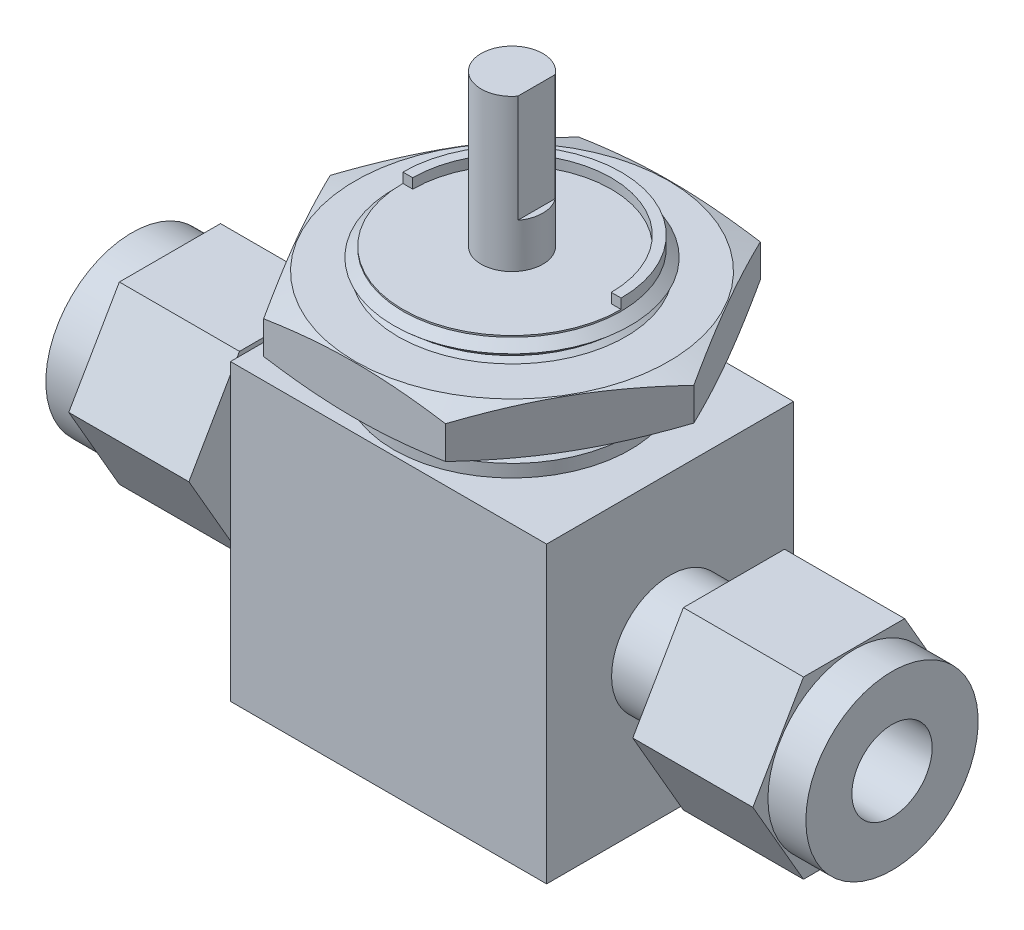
SolidWorks part; units mm, degrees
ref_plane "Front" through (0, 0, 0) normal (0, 0, 1) x (1, 0, 0)
ref_plane "Top" through (0, 0, 0) normal (0, 1, 0) x (1, 0, 0)
ref_plane "Right" through (0, 0, 0) normal (1, 0, 0) x (0, 0, -1)
sketch "Sketch1" plane through (0, 0, 0) normal (0, 0, 1) x (1, 0, 0)
  line L0 (-12.7, 11.8237) -> (12.7, 11.8237)
  line L1 (-12.7, 11.8237) -> (-12.7, -11.8237)
  line L2 (12.7, -11.8237) -> (-12.7, -11.8237)
  line L3 (12.7, -11.8237) -> (12.7, 11.8237)
  dimension "D1" = 25.4
  dimension "D2" = 23.6474
  dimension "D3" = 12.7
  dimension "D4" = 11.8237
extrude "Body" add sketch "Sketch1" along normal blind 9.9187 and the other way blind 9.9187
sketch "Sketch2" plane through (12.7, 0, 0) normal (1, 0, 0) x (0, 0, -1)
  circle A0 centre (0, 0) radius 4.699
  dimension "D1" = 9.398
extrude "Boss" add sketch "Sketch2" along normal blind 5.1308
sketch "Sketch3" plane through (17.8308, 0, 0) normal (1, 0, 0) x (0, 0, -1)
  line L0 (0, 0) -> (13.9578, 0) construction
  line L1 (0, 0) -> (-11.692, 0) construction
  line L2 (-4.064, 7.0391) -> (4.064, 7.0391)
  line L3 (4.064, 7.0391) -> (8.128, 0)
  line L4 (8.128, 0) -> (4.064, -7.0391)
  line L5 (4.064, -7.0391) -> (-4.064, -7.0391)
  line L6 (-4.064, -7.0391) -> (-8.128, 0)
  line L7 (-8.128, 0) -> (-4.064, 7.0391)
  line L8 (0, 0) -> (4.064, 7.0391) construction
  circle A0 centre (0, 0) radius 8.128 construction
  dimension "D1" = 16.256
  dimension "D2" = 60
  dimension "D3" = 8.128
  dimension "D4" = 8.128
  dimension "D5" = 120
  dimension "D6" = 120
  dimension "D7" = 8.128
extrude "Hex" add sketch "Sketch3" along normal blind 9.652
sketch "Sketch4" plane through (27.4828, 0, 0) normal (1, 0, 0) x (0, 0, -1)
  circle A0 centre (0, 0) radius 6.9215
  dimension "D1" = 13.843
extrude "Boss-Extrude3" add sketch "Sketch4" along normal blind 3.048
sketch "Sketch5" plane through (30.5308, 0, 0) normal (1, 0, 0) x (0, 0, -1)
  circle A0 centre (0, 0) radius 3.2258
  dimension "D1" = 6.4516
extrude "TubeBore" cut sketch "Sketch5" against normal blind 15.2908
mirror "Mirror1" about plane through (0, 0, 0) normal (1, 0, 0) of "TubeBore", "Boss", "Hex", "Boss-Extrude3"
sketch "Sketch6" plane through (0, 11.8237, 0) normal (0, 1, 0) x (-1, 0, 0)
  circle A0 centre (0, 0) radius 9.4996
  dimension "D1" = 18.9992
extrude "PackingBoss" add sketch "Sketch6" along normal blind 9.398
sketch "Sketch14" plane through (0, 0, 0) normal (0, 0, 1) x (1, 0, 0)
  line L0 (0, 0) -> (0, 30.8771) construction
  line L1 (9.4996, 12.8397) -> (8.7694, 13.4747)
  line L2 (9.4996, 11.8237) -> (9.4996, 21.2217) construction
  line L3 (8.7694, 13.4747) -> (9.4996, 14.1097)
  line L4 (9.4996, 14.1097) -> (8.7694, 14.7447)
  line L5 (8.7694, 14.7447) -> (9.4996, 15.3797)
  line L6 (9.4996, 15.3797) -> (8.7694, 16.0147)
  line L7 (8.7694, 16.0147) -> (9.4996, 16.6497)
  line L8 (9.4996, 16.6497) -> (8.7694, 17.2847)
  line L9 (8.7694, 17.2847) -> (9.4996, 17.9197)
  line L10 (9.4996, 17.9197) -> (8.7693, 18.5547)
  line L11 (8.7693, 18.5547) -> (9.4996, 19.1897)
  line L12 (9.4996, 19.1897) -> (8.7693, 19.8247)
  line L13 (8.7693, 19.8247) -> (9.4996, 20.4597)
  line L14 (-12.7, 11.8237) -> (12.7, 11.8237) construction
  line L15 (9.4996, 20.4597) -> (8.7694, 21.0947)
  line L18 (8.7694, 21.0947) -> (8.7694, 22.3647)
  line L19 (10.0703, 22.3647) -> (10.0703, 12.8397)
  line L20 (10.0703, 12.8397) -> (9.4996, 12.8397)
  line L23 (8.7694, 22.3647) -> (10.0703, 22.3647)
  dimension "D1" = 17.5387
  dimension "D2" = 1.016
  dimension "D3" = 1.27
revolve "3/4-20 unef" cut sketch "Sketch14" angle 360 about L0
sketch "Sketch7" plane through (0, 21.2217, 0) normal (0, 1, 0) x (-1, 0, 0)
  line L0 (-7.9756, 0) -> (-8.7694, 0)
  line L4 (7.9756, 0) -> (8.7694, 0)
  arc A0 (8.7694, 0) -> (-8.7694, 0) centre (0, 0) cw
  arc A1 (7.9756, 0) -> (-7.9756, 0) centre (0, 0) cw
  circle A2 centre (0, 0) radius 8.7694 construction
  dimension "D1" = 0.7937
extrude "Boss-Extrude4" add sketch "Sketch7" along normal blind 0.7937
sketch "Sketch16" plane through (0, 21.2217, 0) normal (0, 1, 0) x (1, 0, 0)
  circle A0 centre (0, 0) radius 2.4765
  dimension "D1" = 4.953
extrude "Boss-Extrude5" add sketch "Sketch16" along normal blind 12.192
sketch "Sketch17" plane through (0, 33.4137, 0) normal (0, 1, 0) x (1, 0, 0)
  line L1 (1.9685, 6.8634) -> (5.2713, 6.8634)
  line L2 (1.9685, 6.8634) -> (1.9685, -4.4524)
  line L3 (1.9685, -4.4524) -> (5.2713, -4.4524)
  line L4 (5.2713, 6.8634) -> (5.2713, -4.4524)
  circle A0 centre (0, 0) radius 2.4765 construction
  dimension "D1" = 4.445
extrude "Cut-Extrude1" cut sketch "Sketch17" against normal blind 8.636
sketch "Sketch12" plane through (30.5308, 0, 0) normal (1, 0, 0) x (0, 0, -1)
  circle A0 centre (0, 0) radius 2.3749
  dimension "D1" = 4.7498
extrude "Hole" cut sketch "Sketch12" against normal through all
ref_plane "Plane1" through (0, 21.0918, 0) normal (0, 1, 0) x (-1, 0, 0)
sketch "Sketch18" plane through (0, 21.0918, 0) normal (0, 1, 0) x (-1, 0, 0)
  line L1 (-14.606, 0) -> (-7.303, -12.6492)
  line L2 (-7.303, -12.6492) -> (7.303, -12.6492)
  line L3 (7.303, -12.6492) -> (14.606, 0)
  line L4 (14.606, 0) -> (7.303, 12.6492)
  line L5 (7.303, 12.6492) -> (-7.303, 12.6492)
  line L6 (-7.303, 12.6492) -> (-14.606, 0)
  circle A0 centre (0, 0) radius 12.6492 construction
  circle A1 centre (0, 0) radius 9.0678
  dimension "D1" = 25.2984
  dimension "D2" = 18.1356
extrude "Hex Nut" add sketch "Sketch18" against normal blind 3.9116 from offset 1.5875
sketch "Sketch19" plane through (0, 0, 0) normal (0, 0, 1) x (1, 0, 0)
  line L0 (0, 0) -> (0, 41.6089) construction
  line L1 (14.606, 18.8638) -> (12.5848, 19.5043)
  line L2 (14.606, 15.5927) -> (14.606, 19.5043) construction
  line L3 (7.303, 19.5043) -> (14.606, 19.5043) construction
  line L4 (14.606, 16.2332) -> (12.5848, 15.5927)
  line L5 (7.303, 15.5927) -> (14.606, 15.5927) construction
  line L6 (12.5848, 19.5043) -> (12.5848, 15.5927) construction
  line L7 (12.5848, 19.5043) -> (14.606, 19.5043)
  line L8 (14.606, 19.5043) -> (14.606, 18.8638)
  line L9 (14.606, 16.2332) -> (14.606, 15.5927)
  line L10 (14.606, 15.5927) -> (12.5848, 15.5927)
  dimension "D1" = 0.6405
  dimension "D2" = 12.5848
revolve "Cut-Revolve1" cut sketch "Sketch19" angle 360 about L0
sketch "Sketch10" plane through (0, 21.0918, 0) normal (0, 1, 0) x (-1, 0, 0)
  circle A0 centre (0, 0) radius 10.6045
  dimension "D1" = 21.209
extrude "HandleBoss" [suppressed] add sketch "Sketch10" along normal blind 8.255
sketch "Sketch11" [suppressed] plane through (0, 29.3468, 0) normal (0, 1, 0) x (-1, 0, 0)
  line L0 (-24.638, 0) -> (0, 0) construction
  line L2 (-24.638, 0) -> (-16.4612, 5.9191)
  line L3 (-16.4612, 5.9191) -> (0, 10.6045)
  line L4 (0, 10.6045) -> (39.37, 3.1981)
  line L5 (39.37, 0) -> (39.37, -3.1981)
  line L6 (0, -10.6045) -> (39.37, -3.1981)
  line L7 (-16.4612, -5.9191) -> (0, -10.6045)
  line L8 (-24.638, 0) -> (-16.4612, -5.9191)
  line L9 (0, 0) -> (39.37, 0) construction
  line L10 (0, -10.6045) -> (0, 10.6045) construction
  line L11 (39.37, 3.1981) -> (39.37, 0)
  line L12 (0, 0) -> (-50.442, 0) construction
  circle A0 centre (0, 0) radius 10.6045 construction
  dimension "D1" = 159.988
  dimension "D2" = 71.801
  dimension "D3" = 100.654
  dimension "D4" = 39.37
  dimension "D5" = 64.008
  dimension "D6" = 0
extrude "Handle" [suppressed] add sketch "Sketch11" along normal blind 8.382
dome "Dome1" [suppressed] faces to dome 1 distance 1.905 parameters "D1"=1.905
